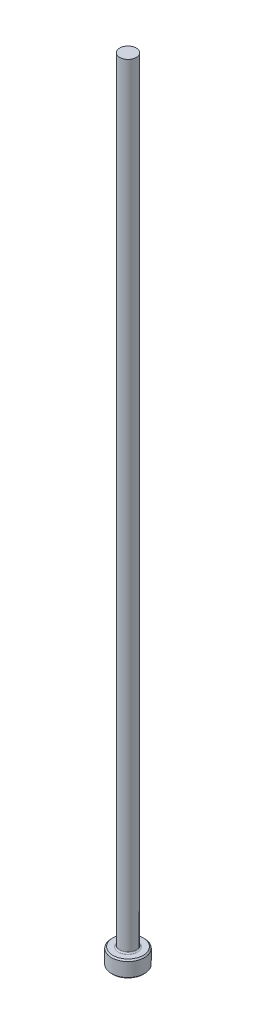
SolidWorks part; units mm, degrees
ref_plane "Front Plane" through (0, 0, 0) normal (0, 0, 1) x (1, 0, 0)
ref_plane "Top Plane" through (0, 0, 0) normal (0, 1, 0) x (1, 0, 0)
ref_plane "Right Plane" through (0, 0, 0) normal (1, 0, 0) x (0, 0, -1)
sketch "Sketch1" plane through (0, 0, 0) normal (0, 0, 1) x (1, 0, 0)
  line L0 (0, 259.9588) -> (0, -15.1925) construction
  line L1 (0, 0) -> (-3.175, 0)
  line L2 (-3.175, 0) -> (-3.175, 3.175)
  line L3 (-3.175, 3.175) -> (-1.5875, 3.175)
  line L4 (-1.5875, 3.175) -> (-1.5875, 152.4)
  line L5 (-1.5875, 152.4) -> (0, 152.4)
  line L6 (0, 152.4) -> (0, 0)
  dimension "L" = 152.4
  dimension "H" = 6.35
  dimension "T" = 3.175
  dimension "D" = 3.175
revolve "Revolve1" add sketch "Sketch1" angle 360 about L0
chamfer "Chamfer1" distance 0.254 angle 45 2 edges at (0, 3.175, 3.175) (0, 0, 3.175)
fillet "Fillet1" radius 0.254 1 edges at (0, 3.175, 1.5875)
sketch "Pocket Sketch" plane through (0, 0, 0) normal (0, 0, 1) x (1, 0, 0)
  line L0 (-3.5719, 0) -> (-3.5719, 3.2004)
  line L1 (-3.5719, 3.2004) -> (-2.5479, 3.2004)
  line L2 (-1.7859, 3.9624) -> (-1.7859, 22.225)
  line L3 (-1.7859, 22.225) -> (0, 22.225)
  line L4 (0, 22.225) -> (0, 0)
  line L5 (0, 0) -> (-3.5719, 0)
  line L6 (0, 12.6104) -> (0, -2.4989) construction
  line L7 (-3.175, 2.921) -> (-3.175, 0.254) construction
  line L8 (2.921, 3.175) -> (-2.921, 3.175) construction
  line L9 (-1.5875, 152.4) -> (-1.5875, 3.429) construction
  line L10 (-2.5479, 3.2004) -> (-1.7859, 3.9624)
  point P3 (-1.7859, 3.2004)
  dimension "D1" = 7.1437
  dimension "D2" = 0.3969
  dimension "D3" = 0.0254
  dimension "D4" = 0.1984
  dimension "D5" = 3.5719
  dimension "D6" = 22.225
